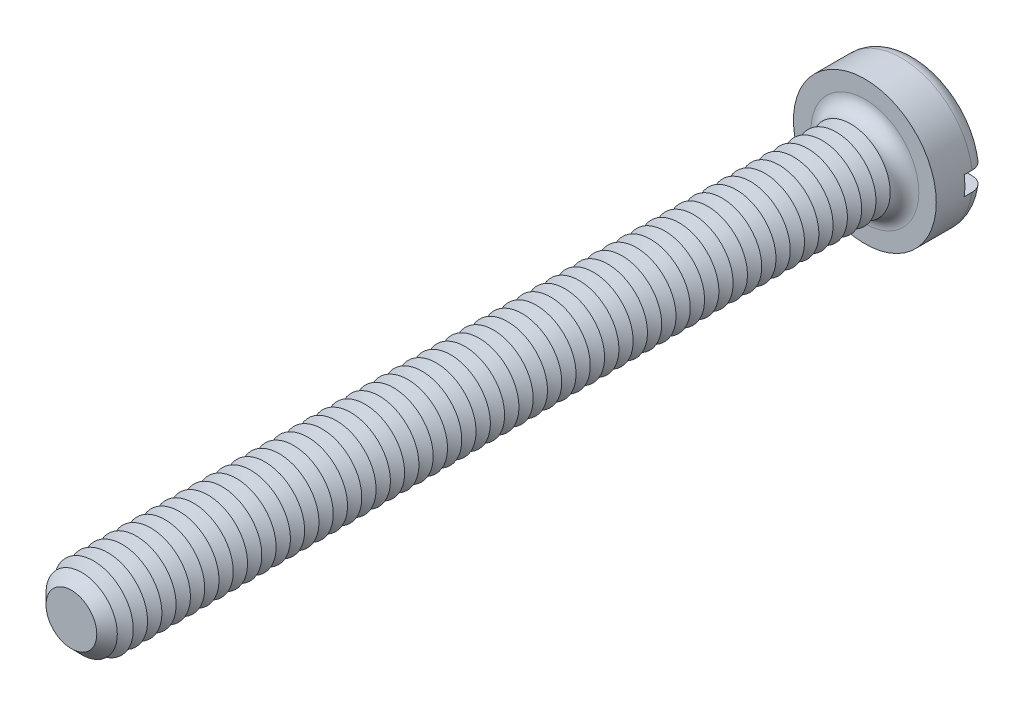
SolidWorks part; units mm, degrees
ref_plane "Front Plane" through (0, 0, 0) normal (0, 0, 1) x (1, 0, 0)
ref_plane "Top Plane" through (0, 0, 0) normal (0, 1, 0) x (1, 0, 0)
ref_plane "Right Plane" through (0, 0, 0) normal (1, 0, 0) x (0, 0, -1)
sketch "Sketch3" plane through (0, 0, 0) normal (0, 0, 1) x (1, 0, 0)
  circle A0 centre (0, 0) radius 2.25
  dimension "D1" = 4.5
extrude "Boss-Extrude2" add sketch "Sketch3" against normal blind 1.6
sketch "Sketch4" plane through (0, 0, 0) normal (0, 0, 1) x (1, 0, 0)
  circle A0 centre (0, 0) radius 1.25
  dimension "D1" = 2.5
extrude "Boss-Extrude3" add sketch "Sketch4" along normal blind 25
fillet "Fillet1" radius 0.45 2 edges at (2.25, 0, -1.6) (1.25, 0, 0)
chamfer "Chamfer1" distance 0.45 angle 45 1 edges at (1.25, 0, 25)
sketch "Sketch5" plane through (0, 0, 0) normal (1, 0, 0) x (0, 0, -1)
  line L0 (1.6944, 0) -> (-7.6738, 0) construction
sketch "Sketch6" plane through (0, 0, 0) normal (1, 0, 0) x (0, 0, -1)
  line L0 (-0.45, 1.25) -> (-0.675, 0.8603)
  line L1 (-0.675, 0.8603) -> (-0.9, 1.25)
  line L2 (-0.45, 1.25) -> (-24.55, 1.25) construction
  line L3 (-0.9, 1.25) -> (-0.45, 1.25)
  dimension "D1" = 0.45
revolve "Cut-Revolve1" cut sketch "Sketch6" angle 360 about L0
pattern_linear "LPattern1" count 54 spacing 0.45 along (0, 0, 1) of "Cut-Revolve1"
sketch "Sketch8" plane through (0, 0, -1.6) normal (0, 0, -1) x (-1, 0, 0)
  line L1 (2.25, -0.3) -> (-2.25, -0.3)
  line L2 (2.25, -0.3) -> (2.25, 0.3)
  line L3 (2.25, 0.3) -> (-2.25, 0.3)
  line L4 (-2.25, -0.3) -> (-2.25, 0.3)
  line L5 (2.25, -0.3) -> (-2.25, 0.3) construction
  line L6 (2.25, 0.3) -> (-2.25, -0.3) construction
  point P0 (0, 0)
  dimension "D1" = 4.5
  dimension "D2" = 0.6
extrude "Cut-Extrude1" cut sketch "Sketch8" against normal blind 0.7
